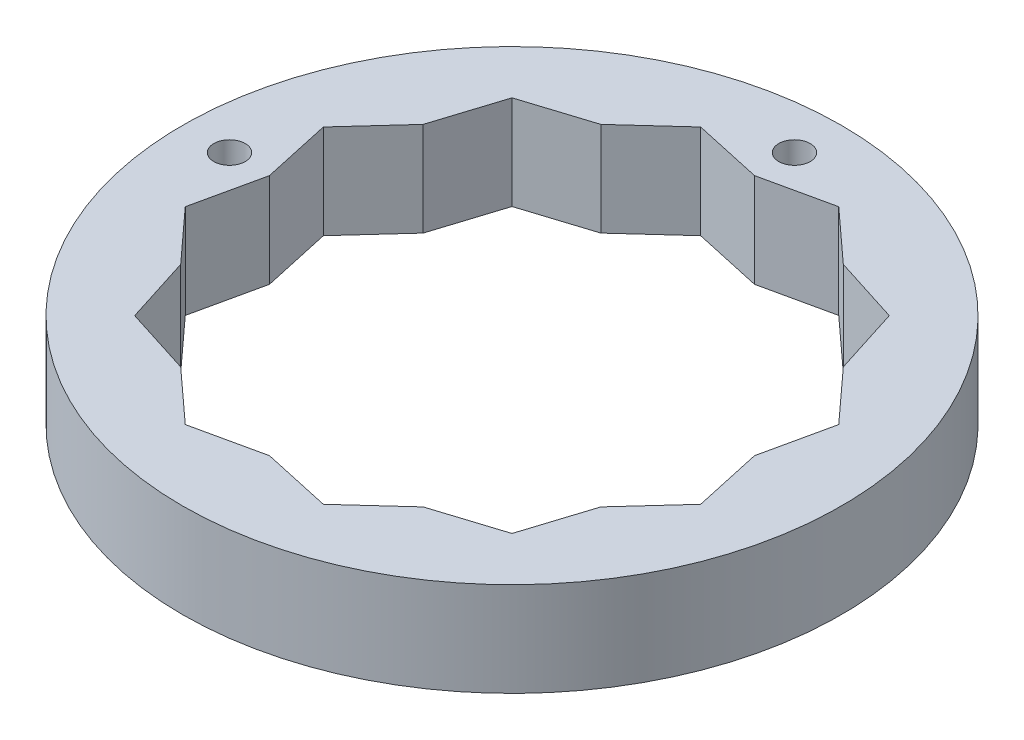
SolidWorks part; units mm, degrees
ref_plane "Front Plane" through (0, 0, 0) normal (0, 0, 1) x (1, 0, 0)
ref_plane "Top Plane" through (0, 0, 0) normal (0, 1, 0) x (1, 0, 0)
ref_plane "Right Plane" through (0, 0, 0) normal (1, 0, 0) x (0, 0, -1)
sketch "Sketch1" plane through (0, 0, 0) normal (0, 1, 0) x (1, 0, 0)
  circle A0 centre (0, 0) radius 10.5
  dimension "D1" = 21
extrude "Boss-Extrude1" add sketch "Sketch1" along normal blind 3
sketch "Sketch2" plane through (0, 0, 0) normal (0, 1, 0) x (1, 0, 0)
  line L0 (0, 0) -> (0, 8) construction
  line L1 (0, 8) -> (0, 8.5) construction
  line L2 (0, 0) -> (2.2, 8.2104) construction
  line L3 (2.0706, 7.7274) -> (-2.0706, 7.7274) construction
  line L4 (0, 0) -> (-2.2, 8.2104) construction
  line L5 (-2.2, 8.2104) -> (0, 7.7274)
  line L6 (0, 7.7274) -> (2.2, 8.2104)
  line L7 (2.2, 8.2104) -> (3.8637, 6.6921)
  line L8 (3.8637, 6.6921) -> (6.0104, 6.0104)
  line L9 (6.0104, 6.0104) -> (6.6921, 3.8637)
  line L10 (6.6921, 3.8637) -> (8.2104, 2.2)
  line L11 (8.2104, 2.2) -> (7.7274, 0)
  line L12 (7.7274, 0) -> (8.2104, -2.2)
  line L13 (8.2104, -2.2) -> (6.6921, -3.8637)
  line L14 (6.6921, -3.8637) -> (6.0104, -6.0104)
  line L15 (6.0104, -6.0104) -> (3.8637, -6.6921)
  line L16 (3.8637, -6.6921) -> (2.2, -8.2104)
  line L17 (2.2, -8.2104) -> (0, -7.7274)
  line L18 (0, -7.7274) -> (-2.2, -8.2104)
  line L19 (-2.2, -8.2104) -> (-3.8637, -6.6921)
  line L20 (-3.8637, -6.6921) -> (-6.0104, -6.0104)
  line L21 (-6.0104, -6.0104) -> (-6.6921, -3.8637)
  line L22 (-6.6921, -3.8637) -> (-8.2104, -2.2)
  line L23 (-8.2104, -2.2) -> (-7.7274, 0)
  line L24 (-7.7274, 0) -> (-8.2104, 2.2)
  line L25 (-8.2104, 2.2) -> (-6.6921, 3.8637)
  line L26 (-6.6921, 3.8637) -> (-6.0104, 6.0104)
  line L27 (-6.0104, 6.0104) -> (-3.8637, 6.6921)
  line L28 (-3.8637, 6.6921) -> (-2.2, 8.2104)
  circle A0 centre (0, 0) radius 8 construction
  circle A1 centre (0, 0) radius 8.5 construction
  point P5 (2.0706, 7.7274)
  point P11 (0, 7.7274)
  dimension "D1" = 16
  dimension "D2" = 0.5
  dimension "D3" = 15
  dimension "D4" = 12
extrude "Cut-Extrude1" cut sketch "Sketch2" along normal blind 3
sketch "Sketch3" plane through (0, 0, 0) normal (0, 1, 0) x (1, 0, 0)
  line L0 (0, 0) -> (0, 9) construction
  line L2 (0, 0) -> (-9, 0) construction
  circle A0 centre (0, 0) radius 9 construction
  circle A2 centre (0, 9) radius 0.5
  circle A3 centre (-9, 0) radius 0.5
  dimension "D1" = 18
  dimension "D2" = 1
  dimension "D3" = 1
extrude "Cut-Extrude2" cut sketch "Sketch3" along normal up to next
